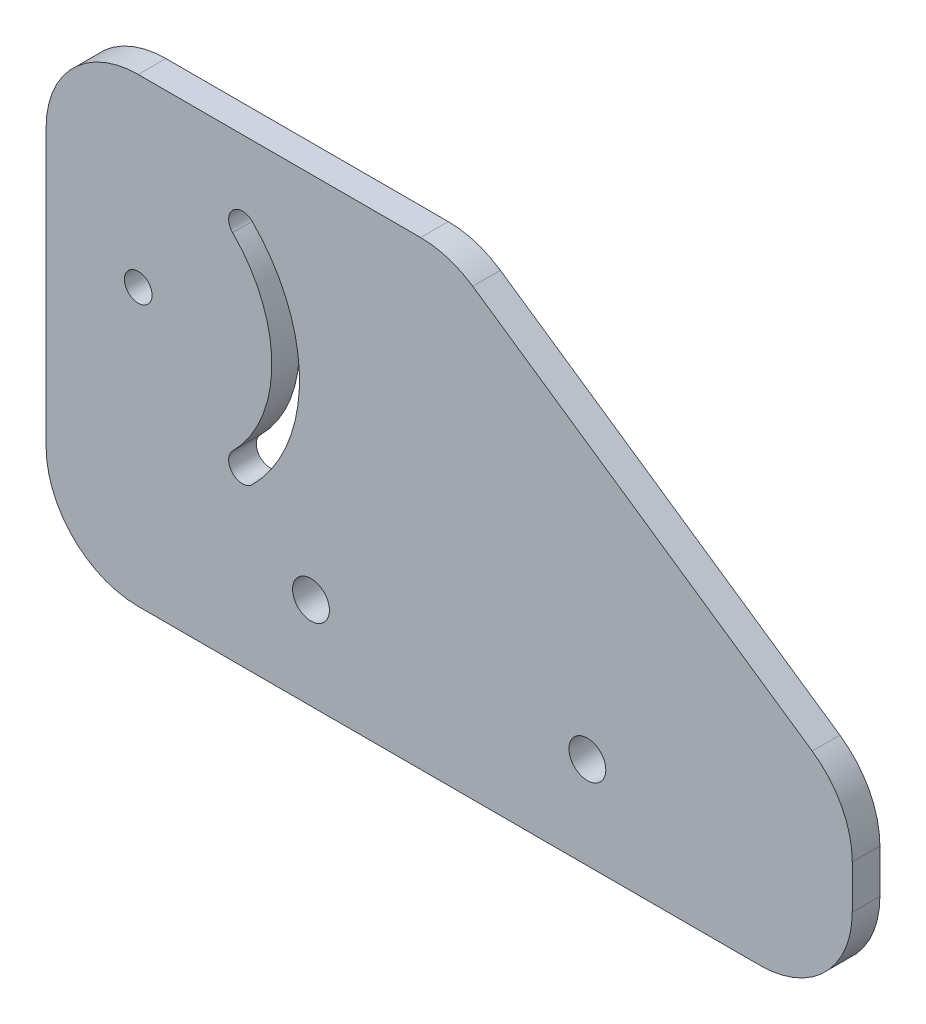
SolidWorks part; units mm, degrees
ref_plane "前视基准面" through (0, 0, 0) normal (0, 0, 1) x (1, 0, 0)
ref_plane "上视基准面" through (0, 0, 0) normal (0, 1, 0) x (1, 0, 0)
ref_plane "右视基准面" through (0, 0, 0) normal (1, 0, 0) x (0, 0, -1)
sketch "草图1" plane through (0, 0, 0) normal (0, 0, 1) x (1, 0, 0)
  line L1 (-43.75, 25) -> (43.75, 25)
  line L2 (-43.75, 25) -> (-43.75, -25)
  line L3 (-43.75, -25) -> (43.75, -25)
  line L4 (43.75, 25) -> (43.75, -25)
  line L5 (-43.75, 25) -> (43.75, -25) construction
  line L6 (-43.75, -25) -> (43.75, 25) construction
  point P0 (0, 0)
  dimension "D1" = 50
  dimension "D2" = 87.5
extrude "凸台-拉伸1" add sketch "草图1" along normal blind 3
hole_wizard "Ø4.0 (4) 直径孔1" positions "草图2" profile "草图3" hole size "Ø4.0" standard "GB"
sketch "草图2" plane through (0, 0, 3) normal (0, 0, 1) x (1, 0, 0)
  line L0 (-43.75, -25) -> (43.75, -25) construction
  point P0 (-15, -15)
  point P2 (15, -15)
  dimension "D1" = 30
  dimension "D2" = 15
  dimension "D3" = 10
  dimension "D4" = 10
sketch "草图3" plane through (-15, -15, 3) normal (1, 0, 0) x (0, -1, 0)
  line L0 (0, 0) -> (0, 3)
  line L1 (0, 3) -> (2, 3)
  line L2 (2, 3) -> (2, 0)
  line L5 (2, 0) -> (0, 0)
  line L11 (0, -6.35) -> (0, 107.95) construction
  dimension "通孔孔直径" = 4
  dimension "通孔孔深度" = 3
sketch "草图5" plane through (0, 0, 3) normal (0, 0, 1) x (1, 0, 0)
  line L0 (0, 25) -> (43.75, 25)
  line L1 (43.75, 25) -> (-43.75, 25) construction
  line L2 (43.75, 25) -> (43.75, -5)
  line L3 (43.75, -5) -> (0, 25)
extrude "切除-拉伸2" cut sketch "草图5" against normal blind 10
sketch "草图6" plane through (0, 0, 3) normal (0, 0, 1) x (1, 0, 0)
  line L2 (0, 25) -> (-43.75, 25) construction
  line L3 (-43.75, 25) -> (-43.75, -25) construction
  circle A0 centre (-33.75, 5) radius 1.5
  arc A1 (-22.4363, 16.3137) -> (-22.4363, -6.3137) centre (-33.75, 5) cw construction
  arc A2 (-21.3756, -7.3744) -> (-21.3756, 17.3744) centre (-33.75, 5) ccw
  arc A3 (-23.497, -5.253) -> (-23.497, 15.253) centre (-33.75, 5) ccw
  arc A4 (-23.497, -5.253) -> (-21.3756, -7.3744) centre (-22.4363, -6.3137) ccw
  arc A5 (-21.3756, 17.3744) -> (-23.497, 15.253) centre (-22.4363, 16.3137) ccw
  point P4 (-17.75, 5)
  dimension "D1" = 3
  dimension "D2" = 1.5
  dimension "D6" = 16
  dimension "D3" = 90
  dimension "D4" = 20
  dimension "D5" = 10
  dimension "D7" = 20
extrude "切除-拉伸3" cut sketch "草图6" against normal blind 24
sketch "草图10" plane through (0, 0, 3) normal (0, 0, 1) x (1, 0, 0)
  line L0 (-17, -15) -> (-13, -15) construction
  line L1 (-17, -13) -> (-13, -13)
  line L2 (-17, -17) -> (-13, -17)
  line L3 (13, -15) -> (17, -15) construction
  line L4 (13, -13) -> (17, -13)
  line L5 (13, -17) -> (17, -17)
  circle A0 centre (-15, -15) radius 2 construction
  arc A1 (-17, -13) -> (-17, -17) centre (-17, -15) ccw
  arc A2 (-13, -17) -> (-13, -13) centre (-13, -15) ccw
  circle A3 centre (15, -15) radius 2 construction
  arc A4 (13, -13) -> (13, -17) centre (13, -15) ccw
  arc A5 (17, -17) -> (17, -13) centre (17, -15) ccw
  point P5 (-15, -15)
  point P10 (15, -15)
  dimension "D1" = 2
  dimension "D2" = 2
extrude "切除-拉伸4" [suppressed] cut sketch "草图10" against normal up to next
fillet "圆角1" radius 10 5 edges at (0, 25, 1.5) (43.75, -5, 1.5) (43.75, -25, 1.5) (-43.75, -25, 1.5) (-43.75, 25, 1.5)
